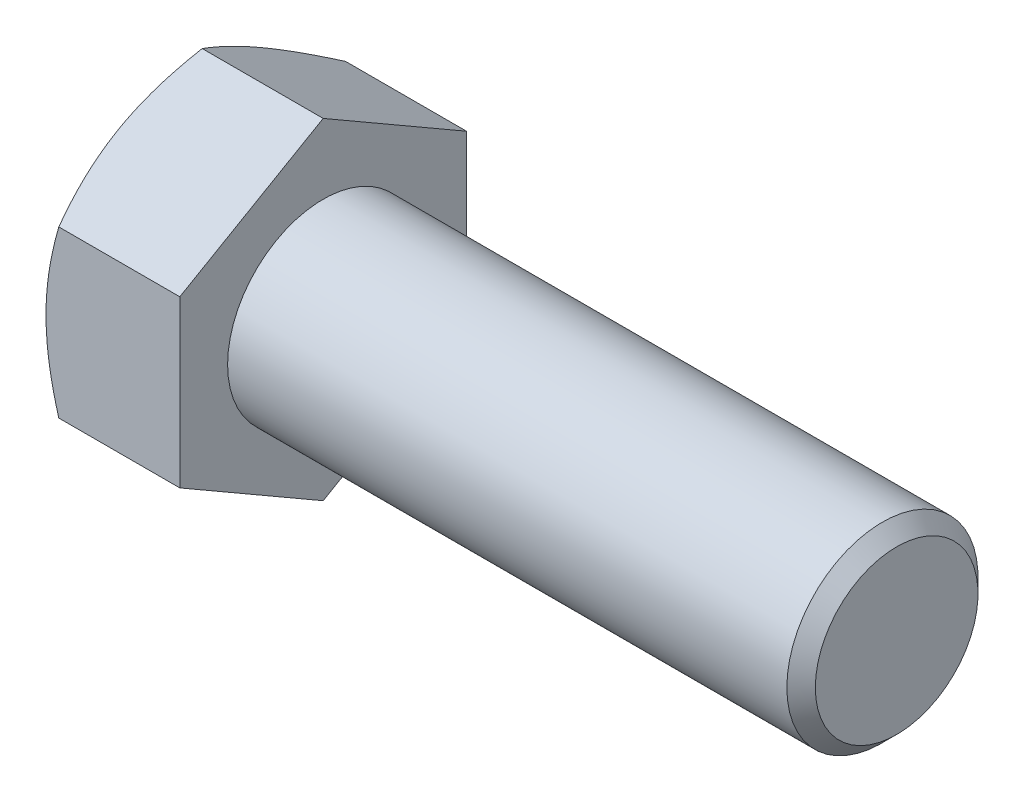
SolidWorks part; units mm, degrees
ref_plane "Plane1" through (0, 0, 0) normal (0, 0, 1) x (1, 0, 0)
ref_plane "Plane2" through (0, 0, 0) normal (0, 1, 0) x (1, 0, 0)
ref_plane "Plane3" through (0, 0, 0) normal (1, 0, 0) x (0, 0, -1)
extrude "BaseHead" add sketch "Sketch1" along normal blind 17.78
sketch "Sketch1" plane through (0, 0, 0) normal (1, 0, 0) x (0, 0, -1)
  line L0 (19.05, 10.9985) -> (19.05, -10.9985)
  line L1 (-19.05, 10.9985) -> (-19.05, -10.9985)
  line L2 (19.05, -10.9985) -> (0, -21.997)
  line L3 (0, -21.997) -> (-19.05, -10.9985)
  line L4 (19.05, 10.9985) -> (0, 21.997)
  line L5 (0, 21.997) -> (-19.05, 10.9985)
  dimension "Width_flats" = 38.1
  dimension "D2" = 120
  dimension "D3" = 19.05
  dimension "D4" = 19.05
  dimension "D5" = 19.05
revolve "BaseBody" add sketch "BodySke" angle 360 about L7
sketch "BodySke" plane through (0, 0, 0) normal (0, 0, 1) x (1, 0, 0)
  line L0 (0, 10.9985) -> (0, -10.9985) construction
  line L1 (0, 0) -> (93.98, 0)
  line L2 (0, 0) -> (0, 12.7)
  line L3 (0, 12.7) -> (92.0877, 12.7)
  line L4 (93.98, 0) -> (93.98, 10.8077)
  line L5 (17.78, 21.997) -> (17.78, 10.9985) construction
  line L6 (93.98, 10.8077) -> (92.0877, 12.7)
  line L7 (0, 0) -> (96.52, 0) construction
  line L8 (93.98, -10.8077) -> (92.0877, -12.7) construction
  line L9 (0, -12.7) -> (92.0877, -12.7) construction
  line L10 (19.8882, 15.24) -> (19.8882, -2.54) construction
  line L11 (62.23, 15.24) -> (62.23, -2.54) construction
  line L12 (17.78, 10.9985) -> (17.78, -10.9985) construction
  dimension "Length" = 76.2
  dimension "Body_ch_ang" = 45
  dimension "Diameter" = 25.4
  dimension "Minor_dia" = 21.6154
  dimension "Advance" = 2.1082
  dimension "Thread_nom" = 31.75
sketch "Sketch3" plane through (0, 0, 0) normal (0, 0, 1) x (1, 0, 0)
  line L0 (0, 19.05) -> (5.3677, 28.347)
  line L1 (0, 21.997) -> (0, 10.9985) construction
  line L2 (5.3677, 28.347) -> (5.3677, 34.697)
  line L3 (5.3677, 34.697) -> (-12.7, 34.697)
  line L4 (-12.7, 34.697) -> (-12.7, 19.05)
  line L5 (-12.7, 19.05) -> (0, 19.05)
  line L6 (0, 0) -> (99.06, 0) construction
  line L7 (17.78, 21.997) -> (0, 21.997) construction
  dimension "D1" = 19.05
  dimension "D2" = 6.35
  dimension "D3" = 12.7
  dimension "D4" = 6.35
  dimension "Head_ch_ang" = 30
revolve "HeadChamfer" cut sketch "Sketch3" angle 360 about L6
fillet "HeadFillet" radius 2.286
sketch "ThdSchSke" plane through (0, 0, 0) normal (0, 0, 1) x (1, 0, 0)
  line L0 (62.23, -10.8077) -> (60.905, -12.7)
  line L1 (62.23, -10.8077) -> (63.555, -12.7)
  line L2 (63.555, -12.7) -> (63.555, -15.875)
  line L3 (-3.175, 0) -> (5.1513, 0) construction
  line L5 (63.555, -15.875) -> (60.905, -15.875)
  line L6 (60.905, -15.875) -> (60.905, -12.7)
  dimension "Thread_minor" = 21.6154
  dimension "Diameter" = 25.4
  dimension "Start" = 62.23
  dimension "SideAngle" = 55
  dimension "VeeAngle" = 70
  dimension "Overcut" = 31.75
revolve "ThreadSchematic" cut sketch "ThdSchSke" angle 360 about L3
pattern_linear "ThdSchPat"
equation "\"D3@Sketch1\" = \"Width_flats@Sketch1\" / 2"
equation "\"D4@Sketch1\" = \"D3@Sketch1\""
equation "\"D5@Sketch1\" = \"D4@Sketch1\""
equation "\"Thread_minor@ThreadCosmetic\" = \"Minor_dia@BodySke\""
equation "\"D1@Sketch3\" = \"Width_flats@Sketch1\" / 2"
equation "\"Thread_length@ThreadCosmetic\" = ((sgn( (\"Length@BodySke\" - \"Advance@BodySke\" ) - \"Thread_nom@BodySke\" )-1)*( (\"Length@BodySke\" - \"Advance@BodySke\" ) - \"Thread_nom@BodySke\" ))/-2+ \"Thread_nom@BodySke\""
equation "\"Thread_minor@ThdSchSke\" = \"Minor_dia@BodySke\""
equation "\"Diameter@ThdSchSke\" = \"Diameter@BodySke\""
equation "\"Overcut@ThdSchSke\" = \"Diameter@BodySke\" * 1.25"
equation "\"Start@ThdSchSke\" = \"Head_ht@BaseHead\" + \"Length@BodySke\" - \"Thread_length@ThreadCosmetic\"  '---Non-countersunk---"
equation "\"Num_threads@ThdSchPat\" = int( \"Thread_length@ThreadCosmetic\" / \"Advance@BodySke\" + 0.999 )  + 1"
equation "\"Advance@ThdSchPat\" = \"Thread_length@ThreadCosmetic\" /  (\"Num_threads@ThdSchPat\" - 1) 'relax it"
equation "\"Num_threads@ThdSchPat\" = \"Num_threads@ThdSchPat\" - sgn( \"Num_threads@ThdSchPat\" - 1) '---chamfered tips only---"
